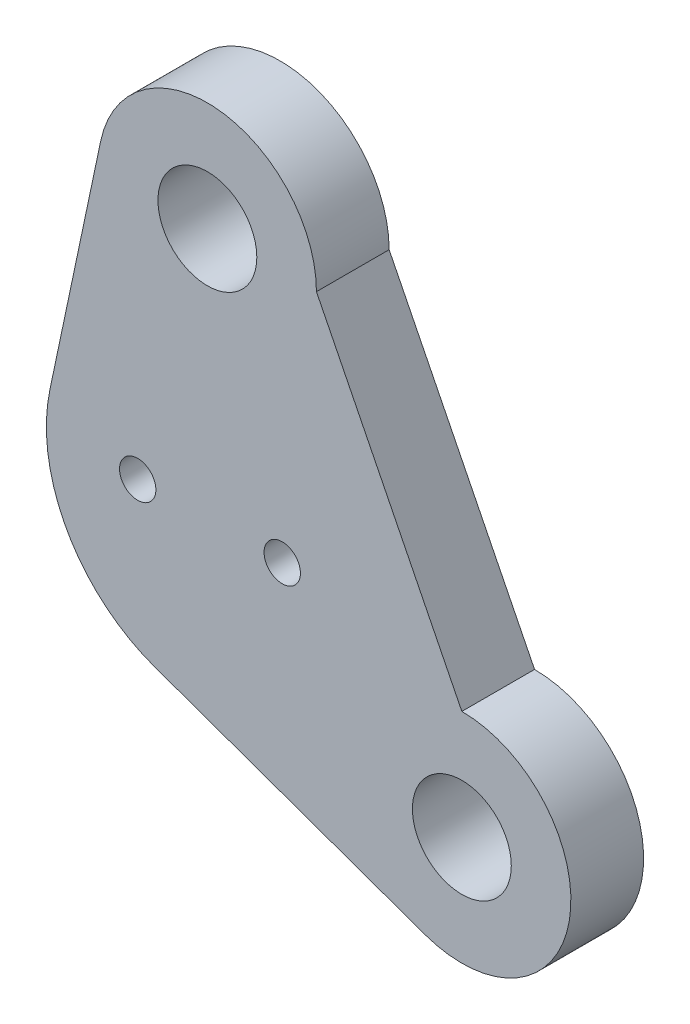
SolidWorks part; units mm, degrees
ref_plane "Front Plane" through (0, 0, 0) normal (0, 0, 1) x (1, 0, 0)
ref_plane "Top Plane" through (0, 0, 0) normal (0, 1, 0) x (1, 0, 0)
ref_plane "Right Plane" through (0, 0, 0) normal (1, 0, 0) x (0, 0, -1)
sketch "Sketch1" plane through (0, 0, 0) normal (0, 0, 1) x (1, 0, 0)
  line L0 (-31.75, 2.54) -> (-26.67, -7.62)
  line L1 (-39.2879, 3.3267) -> (-41.0619, -5.08)
  line L2 (-37.3943, -11.6413) -> (-27.9529, -15.0175)
  circle A0 centre (-35.56, 2.54) radius 3.81 construction
  arc A1 (-31.75, 2.54) -> (-39.2879, 3.3267) centre (-35.56, 2.54) ccw
  circle A2 centre (-26.67, -11.43) radius 3.81 construction
  arc A3 (-27.9529, -15.0175) -> (-26.67, -7.62) centre (-26.67, -11.43) ccw
  arc A4 (-41.0619, -5.08) -> (-37.3943, -11.6413) centre (-35.47, -6.26) ccw
  dimension "D1" = 11.43
extrude "Boss-Extrude1" add sketch "Sketch1" along normal blind 2.54
hole_wizard "#4 Clearance Hole1" positions "Sketch3" profile "Sketch2" hole size "#4" standard "ANSI Inch"
sketch "Sketch3" plane through (0, 0, 2.54) normal (0, 0, 1) x (1, 0, 0)
  point P0 (-26.67, -11.43)
  point P3 (-35.56, 2.54)
sketch "Sketch2" plane through (-26.67, -11.43, 2.54) normal (1, 0, 0) x (0, -1, 0)
  line L0 (0, 0) -> (0, 7.3878)
  line L1 (0, 7.3878) -> (1.7272, 6.35)
  line L2 (1.7272, 6.35) -> (1.7272, 0)
  line L5 (1.7272, 0) -> (0, 0)
  line L10 (0, 7.3878) -> (-1.7272, 6.35) construction
  line L11 (0, -6.35) -> (0, 107.95) construction
  dimension "Hole Dia." = 3.4544
  dimension "Hole Depth" = 6.35
  dimension "Drill Angle" = 118
sketch "Sketch4" plane through (0, 0, 2.54) normal (0, 0, 1) x (1, 0, 0)
  line L0 (-32.67, -6.11) -> (-32.67, -6.41) construction
  line L1 (-32.67, -6.41) -> (-33.22, -6.41) construction
  line L2 (-37.72, -6.41) -> (-38.27, -6.41) construction
  circle A0 centre (-32.945, -6.26) radius 0.635
  circle A1 centre (-37.995, -6.26) radius 0.635
  point P6 (-32.67, -6.26)
  point P9 (-32.945, -6.41)
  point P12 (-37.995, -6.41)
  dimension "D1" = 1.27
extrude "Cut-Extrude1" cut sketch "Sketch4" against normal through all
